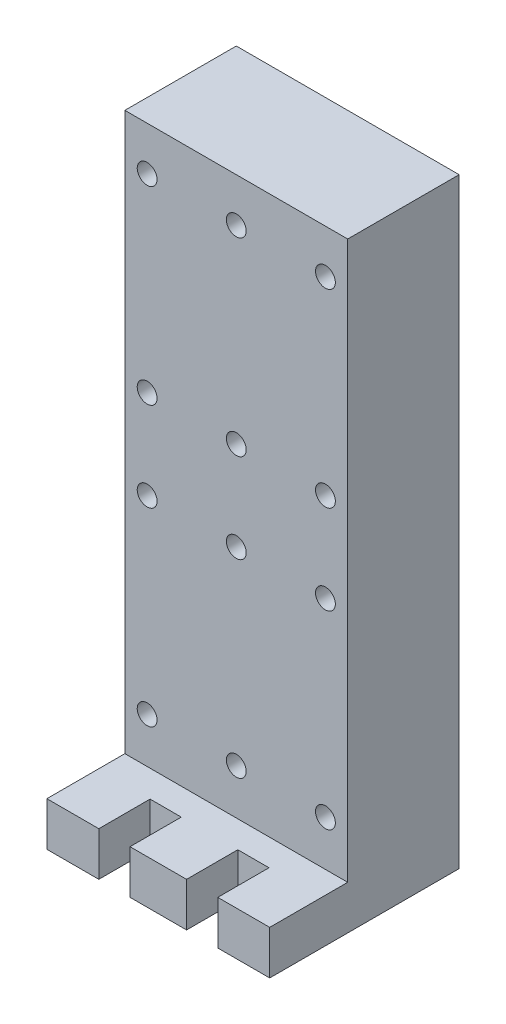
SolidWorks part; units mm, degrees
ref_plane "Front Plane" through (0, 0, 0) normal (0, 0, 1) x (1, 0, 0)
ref_plane "Top Plane" through (0, 0, 0) normal (0, 1, 0) x (1, 0, 0)
ref_plane "Right Plane" through (0, 0, 0) normal (1, 0, 0) x (0, 0, -1)
sketch "Sketch1" plane through (0, 0, 0) normal (0, 1, 0) x (1, 0, 0)
  line L1 (0, 0) -> (25.4, 0)
  line L2 (0, 0) -> (0, 21.59)
  line L3 (0, 21.59) -> (25.4, 21.59)
  line L4 (25.4, 0) -> (25.4, 21.59)
extrude "Boss-Extrude2" add sketch "Sketch1" along normal blind 5
sketch "Sketch3" plane through (0, 5, 0) normal (0, 1, 0) x (1, 0, 0)
  line L1 (0, 21.59) -> (25.4, 21.59)
  line L2 (0, 21.59) -> (0, 8.89)
  line L3 (0, 8.89) -> (25.4, 8.89)
  line L4 (25.4, 21.59) -> (25.4, 8.89)
  line L5 (0, 21.59) -> (0, 0) construction
extrude "Boss-Extrude3" add sketch "Sketch3" along normal blind 63.5
hole_wizard "#43 (0.089) Diameter Hole2" positions "Sketch10" profile "Sketch11" hole size "#43" standard "ANSI Inch"
sketch "Sketch10" plane through (0, 0, -8.89) normal (0, 0, 1) x (1, 0, 0)
  point P0 (2.54, 31.75)
  point P2 (12.7, 31.75)
  point P4 (22.86, 31.75)
  point P6 (2.54, 10.16)
  point P8 (12.7, 10.16)
  point P10 (22.86, 10.16)
sketch "Sketch11" plane through (2.54, 31.75, -8.89) normal (1, 0, 0) x (0, -1, 0)
  line L0 (0, 0) -> (0, 12.7)
  line L1 (0, 12.7) -> (1.1303, 12.7)
  line L2 (1.1303, 12.7) -> (1.1303, 0)
  line L5 (1.1303, 0) -> (0, 0)
  line L11 (0, -6.35) -> (0, 107.95) construction
  dimension "Thru Hole Dia." = 2.2606
  dimension "Thru Hole Depth" = 12.7
hole_wizard "#43 (0.089) Diameter Hole3" positions "Sketch14" profile "Sketch15" hole size "#43" standard "ANSI Inch"
sketch "Sketch14" plane through (0, 0, -8.89) normal (0, 0, 1) x (1, 0, 0)
  point P0 (2.54, 63.5)
  point P2 (12.7, 63.5)
  point P4 (22.86, 63.5)
  point P6 (2.54, 41.91)
  point P8 (12.7, 41.91)
  point P10 (22.86, 41.91)
sketch "Sketch15" plane through (2.54, 63.5, -8.89) normal (1, 0, 0) x (0, -1, 0)
  line L0 (0, 0) -> (0, 12.7)
  line L1 (0, 12.7) -> (1.1303, 12.7)
  line L2 (1.1303, 12.7) -> (1.1303, 0)
  line L5 (1.1303, 0) -> (0, 0)
  line L11 (0, -6.35) -> (0, 107.95) construction
  dimension "Thru Hole Dia." = 2.2606
  dimension "Thru Hole Depth" = 12.7
sketch "Sketch17" plane through (0, 5, 0) normal (0, 1, 0) x (1, 0, 0)
  line L0 (15.922, 5.842) -> (15.922, 0)
  line L1 (5.922, 5.842) -> (9.478, 5.842)
  line L2 (5.922, 5.842) -> (5.922, 0)
  line L3 (5.922, 0) -> (9.478, 0)
  line L4 (9.478, 5.842) -> (9.478, 0)
  line L5 (0, 0) -> (25.4, 0) construction
  line L7 (15.922, 5.842) -> (19.478, 5.842)
  line L9 (15.922, 0) -> (19.478, 0)
  line L10 (19.478, 5.842) -> (19.478, 0)
extrude "Cut-Extrude1" cut sketch "Sketch17" against normal through all
